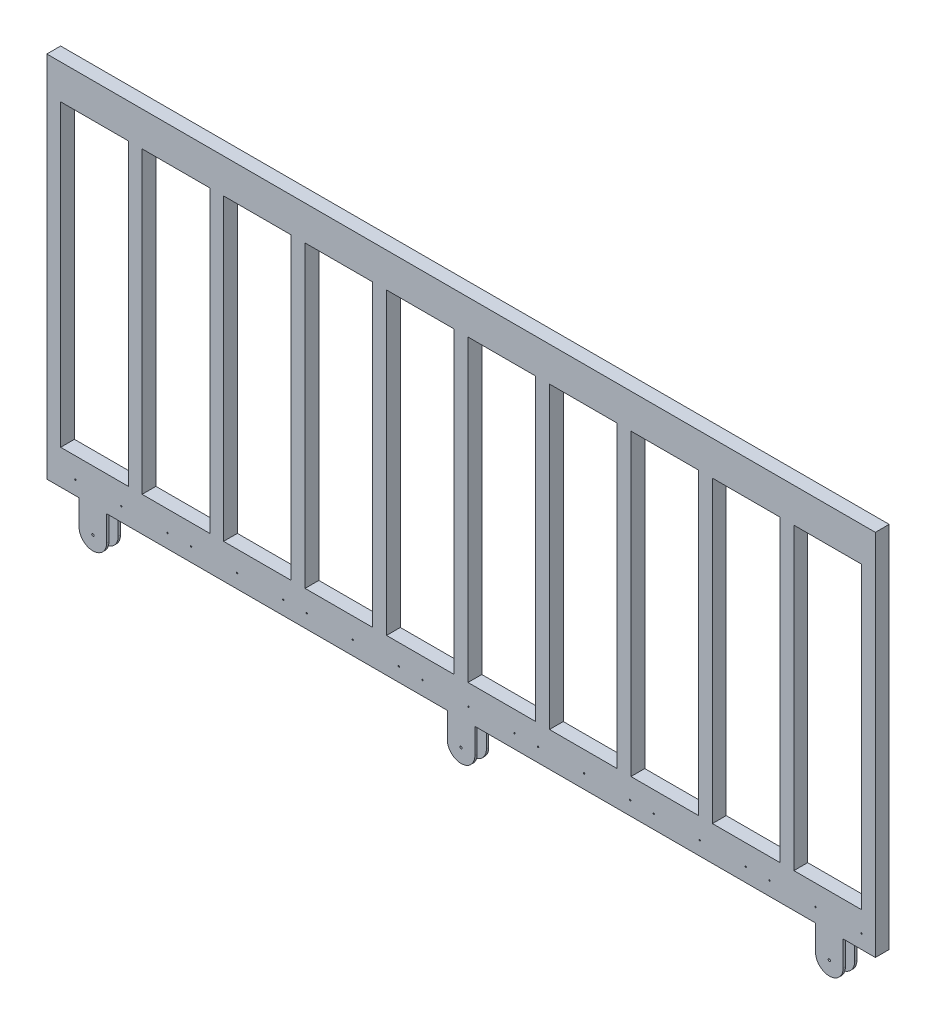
SolidWorks part; units mm, degrees
ref_plane "Plan de face" through (0, 0, 0) normal (0, 0, 1) x (1, 0, 0)
ref_plane "Plan de dessus" through (0, 0, 0) normal (0, 1, 0) x (1, 0, 0)
ref_plane "Plan de droite" through (0, 0, 0) normal (1, 0, 0) x (0, 0, -1)
sketch "Esquisse1" plane through (0, 0, 0) normal (0, 0, 1) x (1, 0, 0)
  line L1 (0, 0) -> (3600, 0)
  line L2 (0, 0) -> (0, 1600)
  line L3 (0, 1600) -> (3600, 1600)
  line L4 (3600, 0) -> (3600, 1600)
  dimension "D1" = 3600
  dimension "D2" = 1600
extrude "Boss.-Extru.1" add sketch "Esquisse1" against normal mid plane 60
sketch "Esquisse2" plane through (0, 0, 30) normal (0, 0, 1) x (1, 0, 0)
  line L0 (0, 800) -> (3591.6944, 800) construction
  line L1 (0, 1600) -> (0, 0) construction
  line L2 (3600, 1600) -> (0, 1600) construction
  line L3 (60, 150) -> (354, 150)
  line L4 (60, 150) -> (60, 1450)
  line L5 (60, 1450) -> (354, 1450)
  line L6 (354, 150) -> (354, 1450)
  line L7 (60, 150) -> (354, 1450) construction
  line L8 (60, 1450) -> (354, 150) construction
  line L9 (414, 150) -> (708, 150)
  line L10 (414, 150) -> (414, 1450)
  line L11 (414, 1450) -> (708, 1450)
  line L12 (708, 150) -> (708, 1450)
  line L13 (414, 150) -> (708, 1450) construction
  line L14 (414, 1450) -> (708, 150) construction
  line L15 (768, 150) -> (1062, 150)
  line L16 (768, 150) -> (768, 1450)
  line L17 (768, 1450) -> (1062, 1450)
  line L18 (1062, 150) -> (1062, 1450)
  line L19 (768, 150) -> (1062, 1450) construction
  line L20 (768, 1450) -> (1062, 150) construction
  line L21 (1122, 150) -> (1416, 150)
  line L22 (1122, 150) -> (1122, 1450)
  line L23 (1122, 1450) -> (1416, 1450)
  line L24 (1416, 150) -> (1416, 1450)
  line L25 (1122, 150) -> (1416, 1450) construction
  line L26 (1122, 1450) -> (1416, 150) construction
  line L27 (1476, 150) -> (1770, 150)
  line L28 (1476, 150) -> (1476, 1450)
  line L29 (1476, 1450) -> (1770, 1450)
  line L30 (1770, 150) -> (1770, 1450)
  line L31 (1476, 150) -> (1770, 1450) construction
  line L32 (1476, 1450) -> (1770, 150) construction
  line L33 (1830, 150) -> (2124, 150)
  line L34 (1830, 150) -> (1830, 1450)
  line L35 (1830, 1450) -> (2124, 1450)
  line L36 (2124, 150) -> (2124, 1450)
  line L37 (1830, 150) -> (2124, 1450) construction
  line L38 (1830, 1450) -> (2124, 150) construction
  line L39 (2184, 150) -> (2478, 150)
  line L40 (2184, 150) -> (2184, 1450)
  line L41 (2184, 1450) -> (2478, 1450)
  line L42 (2478, 150) -> (2478, 1450)
  line L43 (2184, 150) -> (2478, 1450) construction
  line L44 (2184, 1450) -> (2478, 150) construction
  line L45 (2538, 150) -> (2832, 150)
  line L46 (2538, 150) -> (2538, 1450)
  line L47 (2538, 1450) -> (2832, 1450)
  line L48 (2832, 150) -> (2832, 1450)
  line L49 (2538, 150) -> (2832, 1450) construction
  line L50 (2538, 1450) -> (2832, 150) construction
  line L51 (2892, 150) -> (3186, 150)
  line L52 (2892, 150) -> (2892, 1450)
  line L53 (2892, 1450) -> (3186, 1450)
  line L54 (3186, 150) -> (3186, 1450)
  line L55 (2892, 150) -> (3186, 1450) construction
  line L56 (2892, 1450) -> (3186, 150) construction
  line L57 (3246, 150) -> (3540, 150)
  line L58 (3246, 150) -> (3246, 1450)
  line L59 (3246, 1450) -> (3540, 1450)
  line L60 (3540, 150) -> (3540, 1450)
  line L61 (3246, 150) -> (3540, 1450) construction
  line L62 (3246, 1450) -> (3540, 150) construction
  point P4 (207, 800)
  point P12 (561, 800)
  point P17 (915, 800)
  point P22 (1269, 800)
  point P27 (1623, 800)
  point P32 (1977, 800)
  point P37 (2331, 800)
  point P42 (2685, 800)
  point P48 (3039, 800)
  point P53 (3393, 800)
  dimension "D1" = 150
  dimension "D2" = 60
  dimension "D3" = 294
  dimension "D4" = 10
extrude "Enlèv. mat.-Extru.1" cut sketch "Esquisse2" against normal through all
shell "Coque3" thickness 3
sketch "Esquisse3" plane through (0, 0, 30) normal (0, 0, 1) x (1, 0, 0)
  line L0 (1800, 0) -> (1800, 1880.7064) construction
  line L1 (0, 0) -> (3600, 0) construction
  line L2 (1740, 0) -> (1860, 0)
  line L3 (1740, 0) -> (1740, -110)
  line L4 (1860, 0) -> (1860, -110)
  line L5 (3340, 0) -> (3460, 0)
  line L6 (3340, 0) -> (3340, -110)
  line L7 (3460, 0) -> (3460, -110)
  line L8 (1740, 0) -> (1860, 0)
  line L9 (1740, 0) -> (1740, -110)
  line L10 (1860, 0) -> (1860, -110)
  line L11 (140, 0) -> (260, 0)
  line L12 (140, 0) -> (140, -110)
  line L13 (260, 0) -> (260, -110)
  arc A0 (1740, -110) -> (1860, -110) centre (1800, -110) ccw
  circle A1 centre (1800, -110) radius 5
  arc A2 (3340, -110) -> (3460, -110) centre (3400, -110) ccw
  circle A3 centre (3400, -110) radius 5
  arc A4 (1740, -110) -> (1860, -110) centre (1800, -110) ccw
  circle A5 centre (1800, -110) radius 5
  arc A6 (140, -110) -> (260, -110) centre (200, -110) ccw
  circle A7 centre (200, -110) radius 5
  dimension "D2" = 10
  dimension "D1" = 120
  dimension "D5" = 110
  dimension "D3" = 2
  dimension "D4" = 2
extrude "Boss.-Extru.2" add sketch "Esquisse3" against normal blind 10 contours L3 A0 L4 L8 A1 M34 | L12 A6 L13 A7 M34 | L6 A2 L7 A3 M34
mirror "Symétrie1" about plane through (0, 0, 0) normal (0, 0, 1) of "Boss.-Extru.2"
sketch "Esquisse4" plane through (0, 0, 30) normal (0, 0, 1) x (1, 0, 0)
  line L0 (3725.6904, 60) -> (2697.2513, 60) construction
  line L1 (3600, 0) -> (3600, 1600) construction
  line L2 (3460, 0) -> (3600, 0) construction
  circle A0 centre (3540, 60) radius 3
  circle A1 centre (3340, 60) radius 3
  circle A2 centre (3140, 60) radius 3
  dimension "D1" = 6
  dimension "D2" = 60
  dimension "D3" = 60
  dimension "D4" = 3
extrude "Enlèv. mat.-Extru.2" cut sketch "Esquisse4" against normal through all
pattern_linear "Répétition linéaire1" count 7 spacing 502.65 along (-1, 0, 0) of "Enlèv. mat.-Extru.2"
